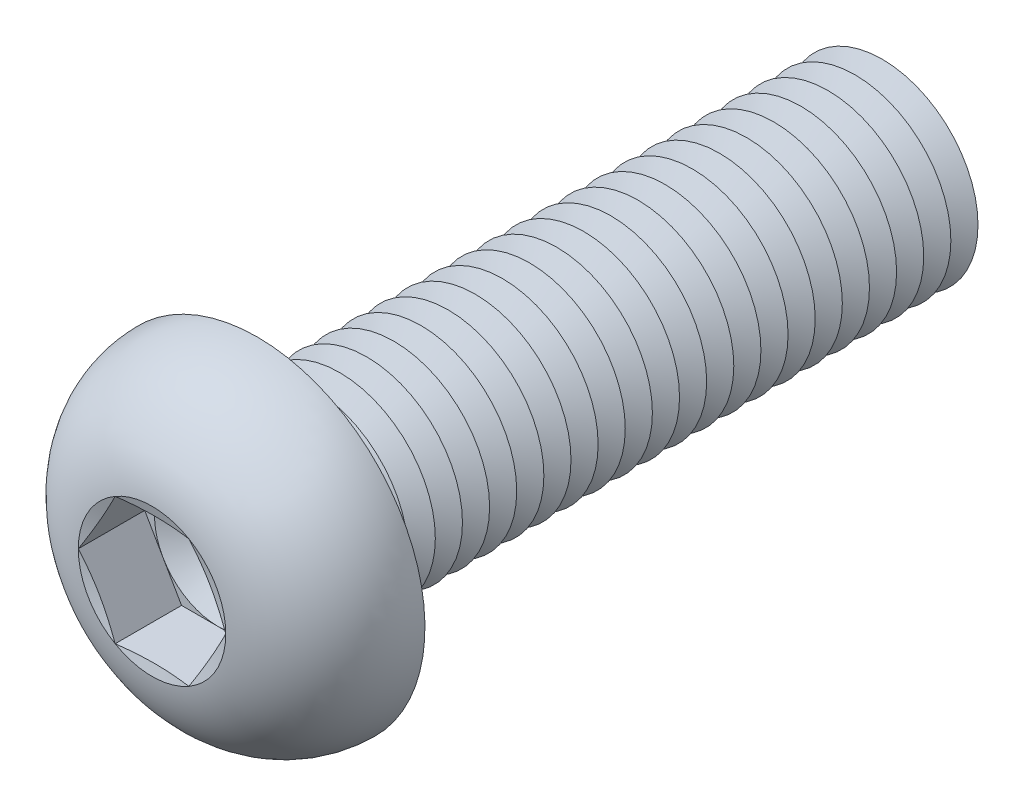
SolidWorks part; units mm, degrees
ref_plane "Front Plane" through (0, 0, 0) normal (0, 0, 1) x (1, 0, 0)
ref_plane "Top Plane" through (0, 0, 0) normal (0, 1, 0) x (1, 0, 0)
ref_plane "Right Plane" through (0, 0, 0) normal (1, 0, 0) x (0, 0, -1)
sketch "Sketch1" plane through (0, 0, 0) normal (1, 0, 0) x (0, 0, -1)
  line L0 (0, 6) -> (0, 10.5)
  line L3 (0, 6) -> (40, 6)
  line L4 (40, 6) -> (40, 0)
  line L5 (40, 0) -> (-6.6, 0) construction
  line L6 (-6.6, 0) -> (40, 0)
  line L7 (-6.6, 4.6188) -> (-6.6, 2.3094) construction
  line L8 (-6.6, 2.3094) -> (-6.6, 0)
  line L9 (-6.6, 4.6188) -> (-5.9812, 2.3094)
  line L10 (-5.9812, 2.3094) -> (-6.6, 2.3094)
  line L11 (40, 0) -> (22.7481, 0) construction
  line L12 (0, 10.5) -> (-6.6, 10.5) construction
  arc A1 (0, 10.5) -> (-6.6, 4.6188) centre (0, 3.8561) ccw
  point P8 (40, 3)
  dimension "D1" = 21
  dimension "D2" = 12
  dimension "D3" = 6.6
  dimension "D4" = 9.2376
  dimension "D5" = 40
  dimension "D6" = 15
revolve "Revolve1" add sketch "Sketch1" angle 360 about L5
fillet "Fillet1" radius 0.85 1 edges at (0, 6, 0)
sketch "Sketch2" plane through (0, 0, 0) normal (1, 0, 0) x (0, 0, -1)
  line L0 (39.15, 6) -> (40.85, 6)
  line L1 (40, 6) -> (0.85, 6) construction
  line L2 (40.85, 6) -> (40, 4.5278)
  line L3 (40, -6) -> (40, 6) construction
  line L4 (40, 4.5278) -> (39.15, 6)
  dimension "D1" = 1.7
revolve "Cut-Revolve1" cut sketch "Sketch2" angle 360 about axis through (0, 0, -40) along (0, 0, -1)
pattern_linear "LPattern1" count 23 spacing 1.7 along (0, 0, 1) of "Cut-Revolve1"
sketch "Sketch3" plane through (0, 0, 6.6) normal (0, 0, 1) x (1, 0, 0)
  line L7 (2.3094, 4) -> (-2.3094, 4)
  line L8 (-2.3094, 4) -> (-4.6188, 0)
  line L9 (-4.6188, 0) -> (-2.3094, -4)
  line L10 (-2.3094, -4) -> (2.3094, -4)
  line L11 (2.3094, -4) -> (4.6188, 0)
  line L12 (4.6188, 0) -> (2.3094, 4)
  circle A0 centre (0, 0) radius 4 construction
  circle A3 centre (0, 0) radius 4.6188 construction
extrude "Cut-Extrude1" cut sketch "Sketch3" against normal blind 4.16
sketch "Sketch4" plane through (0, 0, 2.44) normal (0, 0, 1) x (1, 0, 0)
  line L1 (2.3094, 4) -> (-2.3094, 4) construction
  circle A0 centre (0, 0) radius 4
extrude "Cut-Extrude2" cut sketch "Sketch4" against normal through all draft 60
